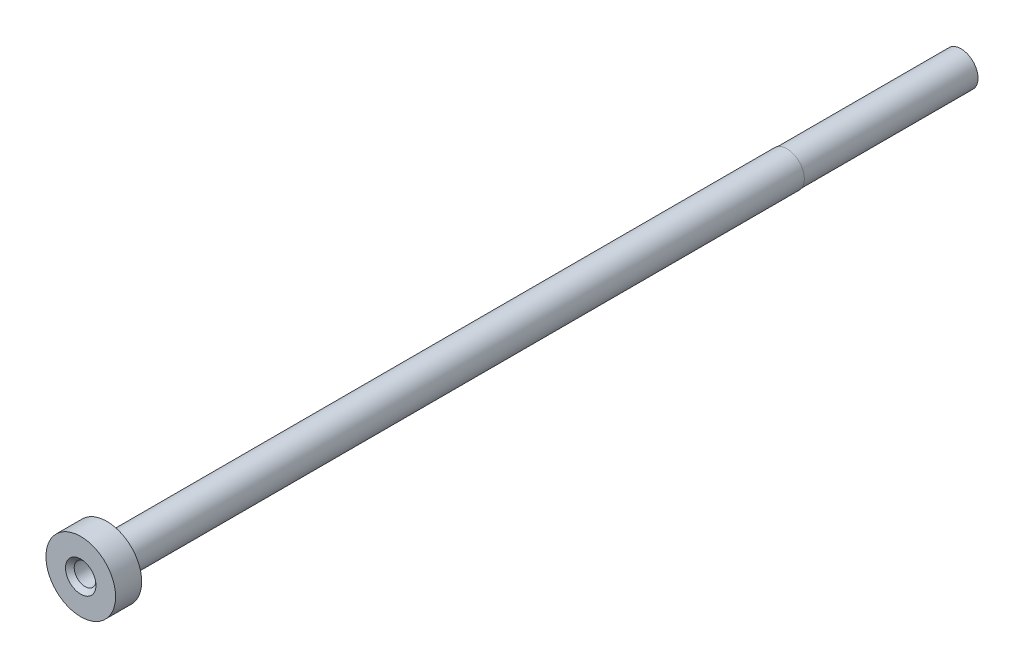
SolidWorks part; units mm, degrees
ref_plane "Face" through (0, 0, 0) normal (0, 0, 1) x (1, 0, 0)
ref_plane "Dessus" through (0, 0, 0) normal (0, 1, 0) x (1, 0, 0)
ref_plane "Droite" through (0, 0, 0) normal (1, 0, 0) x (0, 0, -1)
sketch "Esquisse1" plane through (0, 0, 0) normal (0, 0, 1) x (1, 0, 0)
  circle A0 centre (0, 0) radius 4
  dimension "D1" = 8
extrude "Tête" add sketch "Esquisse1" against normal blind 3
sketch "Esquisse2" plane through (0, 0, -3) normal (0, 0, -1) x (-1, 0, 0)
  circle A0 centre (0, 0) radius 2
  dimension "D1" = 4
extrude "Longueur totale" add sketch "Esquisse2" along normal offset from surface (122 mm away) 125
sketch "Esquisse3" plane through (0, 0, 0) normal (0, 0, 1) x (1, 0, 0)
  circle A0 centre (0, 0) radius 1.25
  dimension "D1" = 2.5
extrude "Passage" cut sketch "Esquisse3" against normal offset from surface (90 mm away) 35
sketch "Esquisse4" plane through (0, 0, -125) normal (0, 0, -1) x (-1, 0, 0)
  circle A0 centre (0, 0) radius 1.1
  dimension "D1" = 2.2
extrude "Guidage" cut sketch "Esquisse4" against normal up to next
fillet "Congé1" radius 0.3
chamfer "Chanfrein1" distance 0.5 angle 45
sketch "Esquisse5" plane through (0, 0, -125) normal (0, 0, -1) x (-1, 0, 0)
  circle A0 centre (0, 0) radius 1.1 construction
  circle A1 centre (0, 0) radius 2
  circle A2 centre (0, 0) radius 2
  circle A3 centre (0, 0) radius 1.1
  dimension "D1" = 0
extrude "Mise à Longueur" cut sketch "Esquisse5" against normal up to surface (23.8757 mm away)
sketch "Esquisse6" plane through (0, 0, -101.1243) normal (0, 0, -1) x (-1, 0, 0)
  circle A0 centre (0, 0) radius 1.9526 construction
  circle A1 centre (0, 0) radius 1.9526
  circle A2 centre (0, 0) radius 2 construction
  circle A3 centre (0, 0) radius 2
extrude "Ajustement au diam" cut sketch "Esquisse6" against normal up to surface (20 mm away)
